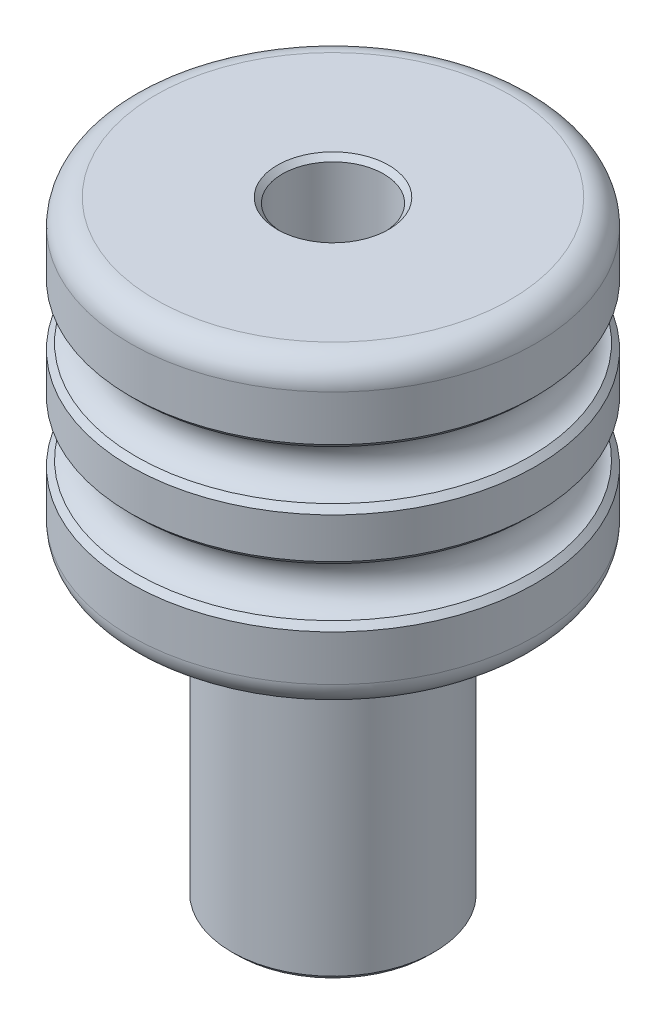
SolidWorks part; units mm, degrees
ref_plane "Спереди" through (0, 0, 0) normal (0, 0, 1) x (1, 0, 0)
ref_plane "Сверху" through (0, 0, 0) normal (0, 1, 0) x (1, 0, 0)
ref_plane "Справа" through (0, 0, 0) normal (1, 0, 0) x (0, 0, -1)
sketch "Эскиз1" plane through (0, 0, 0) normal (1, 0, 0) x (0, 0, -1)
  line L0 (0, 0) -> (0, 12) construction
  line L1 (1, 0) -> (1, 12)
  line L2 (1, 12) -> (3.5, 12)
  line L3 (4, 11.5) -> (4, 10.5)
  line L4 (3.5, 6) -> (2, 6)
  line L5 (2, 6) -> (2, 0)
  line L6 (2, 0) -> (1, 0)
  line L7 (4, 9.5) -> (4, 8.5)
  line L8 (4, 7.5) -> (4, 6.5)
  arc A0 (4, 6.5) -> (3.5, 6) centre (3.5, 6.5) cw
  arc A1 (3.5, 12) -> (4, 11.5) centre (3.5, 11.5) cw
  arc A2 (4, 10.5) -> (4, 9.5) centre (4, 10) ccw
  arc A3 (4, 8.5) -> (4, 7.5) centre (4, 8) ccw
  dimension "D6" = 0.5
  dimension "D7" = 0.5
  dimension "D1" = 2
  dimension "D2" = 4
  dimension "D3" = 8
  dimension "D4" = 12
  dimension "D5" = 6
  dimension "D8" = 1
  dimension "D9" = 2
revolve "Повернуть1" add sketch "Эскиз1" angle 360 about L0
chamfer "Фаска1" distance 0.1 angle 45 8 edges at (0, 0, -2) (0, 6, -2) (0, 12, -1) (0, 0, -1) (0, 7.5, -4) (0, 8.5, -4) (0, 9.5, -4) (0, 10.5, -4)
